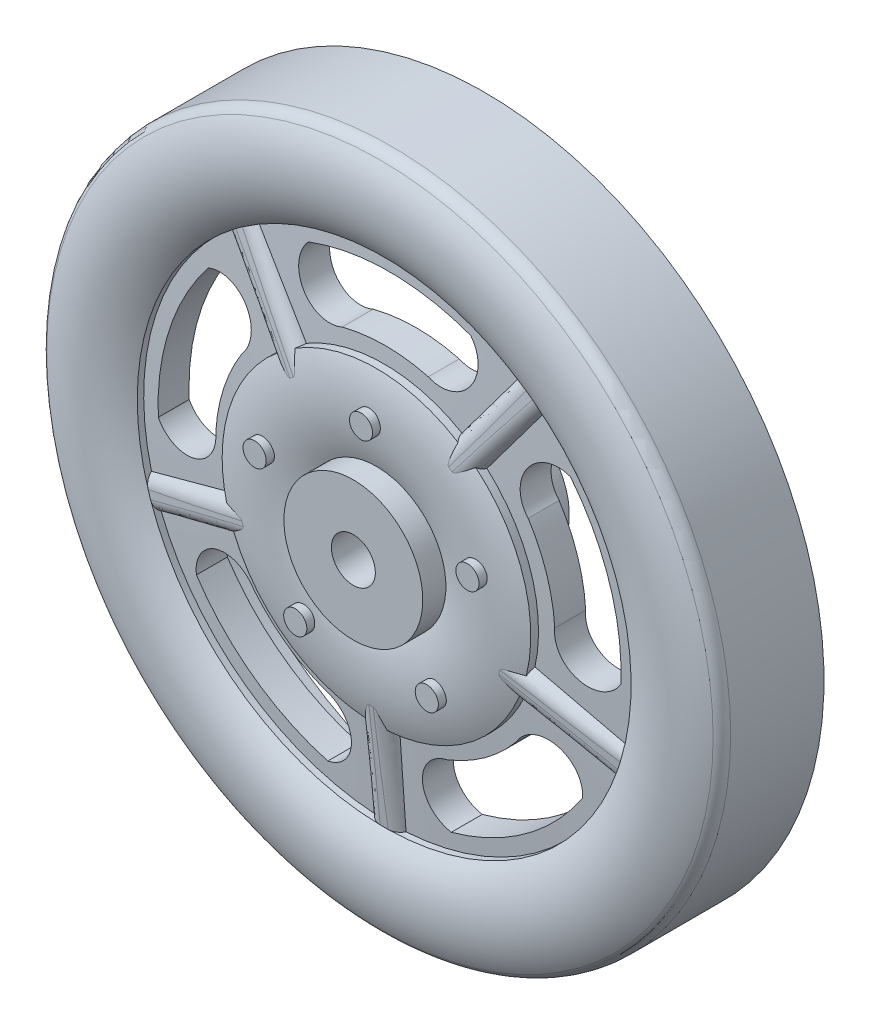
SolidWorks part; units mm, degrees
ref_plane "Plan de face" through (0, 0, 0) normal (0, 0, 1) x (1, 0, 0)
ref_plane "Plan de dessus" through (0, 0, 0) normal (0, 1, 0) x (1, 0, 0)
ref_plane "Plan de droite" through (0, 0, 0) normal (1, 0, 0) x (0, 0, -1)
sketch "Esquisse1" plane through (0, 0, 0) normal (0, 1, 0) x (1, 0, 0)
  line L0 (-9.5432, 0) -> (53.1323, 0) construction
  line L1 (0, 19.7061) -> (0, -20.2019) construction
  line L2 (22, 40.032) -> (22, -8.5517) construction
  line L3 (-12.8761, 8.5) -> (53.1323, 8.5) construction
  line L4 (1.425, 10.8829) -> (1.425, -18.494) construction
  line L5 (4.5, 10.8829) -> (4.5, -18.494) construction
  line L6 (3.1787, 0.5) -> (17.981, 0.5) construction
  line L7 (37.2638, 7.5) -> (65.4001, 7.5) construction
  line L8 (38.1037, 1) -> (66.135, 1) construction
  line L9 (16, 8.5) -> (16, -13.9545) construction
  line L10 (10, 3.3316) -> (10, -9.1026) construction
  line L11 (22, 7.5) -> (22, 1)
  line L12 (35.6933, 1.4167) -> (45.6989, 1.4167) construction
  line L13 (16, 1) -> (16, 1.4167)
  line L14 (3.1787, 1) -> (16.0713, 1) construction
  line L15 (10, 0.5) -> (10, 1)
  line L16 (10, 1) -> (16, 1.4167)
  line L17 (4.5, 0.5) -> (4.5, 0)
  line L18 (4.5, 0) -> (4.5, -1)
  line L19 (8, 2.0486) -> (8, 2.8659)
  line L20 (8, 2.8659) -> (18, 3.5604)
  line L21 (18, 2.1716) -> (18, 3.5604)
  line L22 (20, 7.5) -> (20, 2.1716)
  line L23 (2.5, 4.4626) -> (2.5, 0) construction
  line L24 (1.425, 0) -> (1.425, 8.5)
  line L25 (1.425, 8.5) -> (4.5, 8.5)
  line L26 (4.5, 8.5) -> (4.5, 2.6917)
  line L27 (20, 7.5) -> (22, 7.5)
  line L28 (0.6798, -1) -> (5.4816, -1) construction
  line L29 (4.5, -1) -> (1.425, -1)
  line L30 (1.425, -1) -> (1.425, 0)
  line L31 (-8.72, 10) -> (8.7516, 10) construction
  arc A0 (16, 1) -> (22, 1) centre (19, 5) ccw
  arc A1 (4.5, 0.5) -> (10, 0.5) centre (7.25, 7.8124) ccw
  arc A2 (4.5, 2.6917) -> (8, 2.0486) centre (7.25, 7.8124) ccw
  arc A3 (18, 2.1716) -> (20, 2.1716) centre (19, 5) ccw
  arc A4 (2.5, 4.4626) -> (8, 2.0486) centre (7.25, 7.8124) ccw construction
  dimension "D1" = 2
revolve "Révolution1" add sketch "Esquisse1" angle 360 about L1
sketch "Esquisse2" plane through (0, 0, 0) normal (0, 0, 1) x (1, 0, 0)
  line L0 (0, 0) -> (70.2258, 0) construction
  line L1 (70.2258, 0) -> (0, 0) construction
  line L2 (0, 0) -> (37.7738, 51.9912) construction
  line L3 (0, 0) -> (-43.3396, 59.6518) construction
  line L5 (3.2361, 2.3511) -> (-40.1035, 62.003) construction
  line L6 (0, 0) -> (0, 53.8968) construction
  line L7 (-10.907, 12.0301) -> (26.5978, 12.0301) construction
  arc A0 (2.7869, 10.6411) -> (-2.7869, 10.6411) centre (0, 0) ccw
  arc A1 (5.2614, 14.047) -> (-5.2614, 14.047) centre (0, 0) ccw
  arc A2 (-2.7869, 10.6411) -> (-5.2614, 14.047) centre (-3.6532, 12.6135) cw
  arc A3 (2.7869, 10.6411) -> (5.2614, 14.047) centre (3.6532, 12.6135) ccw
  arc A4 (-10.9815, 0.6377) -> (-14.9853, -0.6632) centre (-13.1251, 0.4234) cw
  arc A5 (-9.2591, 5.9388) -> (-10.9815, 0.6377) centre (0, 0) ccw
  arc A6 (-9.2591, 5.9388) -> (-11.7336, 9.3447) centre (-10.8673, 7.3722) ccw
  arc A7 (-11.7336, 9.3447) -> (-14.9853, -0.6632) centre (0, 0) ccw
  arc A8 (-4, -10.247) -> (-4, -14.4568) centre (-4.4585, -12.3519) cw
  arc A9 (-8.5094, -6.9707) -> (-4, -10.247) centre (0, 0) ccw
  arc A10 (-8.5094, -6.9707) -> (-12.5132, -8.2716) centre (-10.3696, -8.0573) ccw
  arc A11 (-12.5132, -8.2716) -> (-4, -14.4568) centre (0, 0) ccw
  arc A12 (8.5094, -6.9707) -> (12.5132, -8.2716) centre (10.3696, -8.0573) cw
  arc A13 (4, -10.247) -> (8.5094, -6.9707) centre (0, 0) ccw
  arc A14 (4, -10.247) -> (4, -14.4568) centre (4.4585, -12.3519) ccw
  arc A15 (4, -14.4568) -> (12.5132, -8.2716) centre (0, 0) ccw
  arc A16 (9.2591, 5.9388) -> (11.7336, 9.3447) centre (10.8673, 7.3722) cw
  arc A17 (10.9815, 0.6377) -> (9.2591, 5.9388) centre (0, 0) ccw
  arc A18 (10.9815, 0.6377) -> (14.9853, -0.6632) centre (13.1251, 0.4234) ccw
  arc A19 (14.9853, -0.6632) -> (11.7336, 9.3447) centre (0, 0) ccw
  dimension "D1" = 54
  dimension "D2" = 54
  dimension "D4" = 4
extrude "Enlèv. mat.-Extru.1" cut sketch "Esquisse2" against normal through all
sketch "Esquisse3" plane through (0, 0, 0) normal (0, 0, 1) x (1, 0, 0)
  circle A0 centre (0, 0) radius 7.25 construction
  circle A1 centre (0, 7.25) radius 0.75
  circle A2 centre (-6.8952, 2.2404) radius 0.75
  circle A3 centre (-4.2614, -5.8654) radius 0.75
  circle A4 centre (4.2614, -5.8654) radius 0.75
  circle A5 centre (6.8952, 2.2404) radius 0.75
extrude "Extrusion1" add sketch "Esquisse3" along normal mid plane 1
sketch "Esquisse5" plane through (0, 0, 0) normal (1, 0, 0) x (0, 0, -1)
  line L0 (1, -8.5321) -> (1.4167, -18.5877) construction
  line L1 (1, 10) -> (1, -10) construction
  line L2 (1.4167, -16) -> (1.4167, 16) construction
  line L3 (0.1198, -8.5321) -> (1, -16.0001)
  line L4 (1, -16.0001) -> (1.4246, -15.9861)
  line L5 (1.4246, -15.9861) -> (1, -8.5321)
  line L6 (1, -8.5321) -> (0.1198, -8.5321)
extrude "Extrusion2" add sketch "Esquisse5" along normal mid plane 2
fillet "Congé variable2" radius 0.866 12 edges at (-1, -15.9687, -1.2083) (1, -15.9687, -1.2083) (-0.0532, -8.7518, -0.1457) (-1, -12.2859, -0.5623) (1, -9.9499, -0.75) (1, 11.2184, -14.5154) (1, -12.2859, -0.5623) (-1, -9.9499, -0.75) (-1, 11.2184, -14.5154)
pattern_circular "Répétition circulaire3" count 5 every 72 about axis through (0, 0, -19.7061) along (0, 0, 1) of "Extrusion2", "Congé variable2"
fillet "Congé4" radius 0.85 1 edges at (-22, 0, -1)
